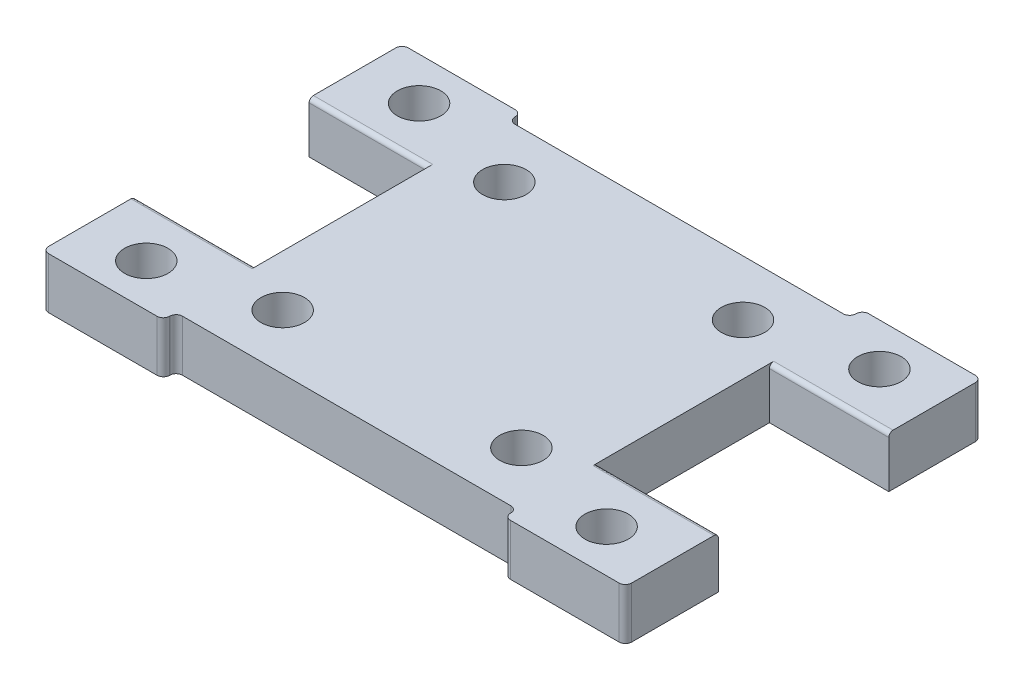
SolidWorks part; units mm, degrees
ref_plane "Front Plane" through (0, 0, 0) normal (0, 0, 1) x (1, 0, 0)
ref_plane "Top Plane" through (0, 0, 0) normal (0, 1, 0) x (1, 0, 0)
ref_plane "Right Plane" through (0, 0, 0) normal (1, 0, 0) x (0, 0, -1)
sketch "Sketch1" plane through (0, 0, 0) normal (0, 1, 0) x (1, 0, 0)
  line L0 (20, 19.5) -> (20, -19.5) construction
  line L1 (-19.26, -19.5) -> (19.26, -19.5)
  line L3 (-19.26, 19.5) -> (19.26, 19.5)
  line L5 (20, 20.24) -> (20, 20.26)
  line L7 (20.74, 21) -> (34, 21)
  line L8 (20, 19.5) -> (-20, -19.5) construction
  line L9 (-20, 19.5) -> (20, -19.5) construction
  line L10 (0, 0) -> (0, 19.5) construction
  line L11 (0, 0) -> (-20, 0) construction
  line L13 (34.2, -21) -> (20.74, -21)
  line L14 (20, -20.26) -> (20, -20.24)
  line L16 (20, 10.1) -> (34, 10.1)
  line L18 (34.2, -10.099) -> (20, -10.099)
  line L19 (20, -10.099) -> (20, 10.1)
  line L20 (-20, 19.5) -> (-20, -19.5) construction
  line L21 (-20, -10.099) -> (-20, 10.1)
  line L22 (-34.2, -10.099) -> (-20, -10.099)
  line L24 (-20, 10.1) -> (-34, 10.1)
  line L25 (-20, -20.26) -> (-20, -20.24)
  line L26 (-34.2, -21) -> (-20.74, -21)
  line L28 (-20.74, 21) -> (-34, 21)
  line L29 (-20, 20.24) -> (-20, 20.26)
  line L30 (34, 10.1) -> (34, 21)
  line L31 (34.2, -10.099) -> (34.2, -21)
  line L32 (-34.2, -10.099) -> (-34.2, -21)
  line L33 (-34, 10.1) -> (-34, 21)
  circle A0 centre (-14, 13) radius 2.55
  circle A1 centre (14, 13) radius 2.55
  circle A2 centre (14, -13) radius 2.55
  circle A3 centre (-14, -13) radius 2.55
  circle A4 centre (27, 16) radius 2.55
  circle A5 centre (27, -16) radius 2.55
  circle A6 centre (-27, -16) radius 2.55
  circle A7 centre (-27, 16) radius 2.55
  arc A12 (-20.74, 21) -> (-20, 20.26) centre (-20.74, 20.26) cw
  arc A13 (-20, 20.24) -> (-19.26, 19.5) centre (-19.26, 20.24) ccw
  arc A14 (20, 20.26) -> (20.74, 21) centre (20.74, 20.26) cw
  arc A15 (19.26, 19.5) -> (20, 20.24) centre (19.26, 20.24) ccw
  arc A16 (19.26, -19.5) -> (20, -20.24) centre (19.26, -20.24) cw
  arc A17 (20.74, -21) -> (20, -20.26) centre (20.74, -20.26) cw
  arc A18 (-20, -20.26) -> (-20.74, -21) centre (-20.74, -20.26) cw
  arc A19 (-19.26, -19.5) -> (-20, -20.24) centre (-19.26, -20.24) ccw
  point P0 (0, 0)
  point P1 (27.1, -16)
  point P46 (27, 10.1)
  point P48 (36, 21)
  point P51 (36, -21)
  point P54 (-36, -21)
  point P57 (-36, 21)
  point P60 (-20, 21)
  point P66 (20, 21)
  point P75 (20, -21)
  point P78 (-20, -21)
  dimension "D5" = 5.1
  dimension "D12" = 20.2
  dimension "D9" = 5.1
  dimension "D1" = 1.5
  dimension "D2" = 39
  dimension "D3" = 40
  dimension "D4" = 1.5
  dimension "D6" = 14
  dimension "D7" = 6.5
  dimension "D8" = 16
  dimension "D10" = 16
  dimension "D11" = 14
extrude "Boss-Extrude1" add sketch "Sketch1" along normal blind 6
fillet "Fillet1" radius 0.74 4 edges at (-34, 3, -21) (-34.2, 3, 21) (34.2, 3, 21) (34, 3, -21)
fillet "Fillet2" radius 0.5 4 edges at (-27, 6, -10.1) (-27.1, 6, 10.099) (27, 6, -10.1) (27.1, 6, 10.099)
